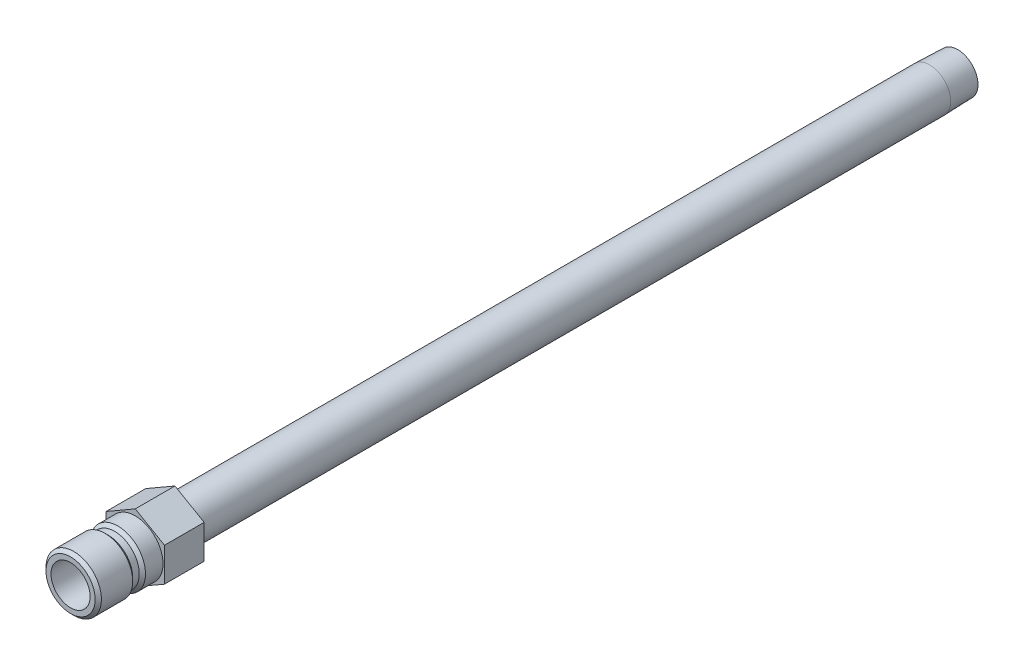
SolidWorks part; units mm, degrees
ref_plane "Front Plane" through (0, 0, 0) normal (0, 0, 1) x (1, 0, 0)
ref_plane "Top Plane" through (0, 0, 0) normal (0, 1, 0) x (1, 0, 0)
ref_plane "Right Plane" through (0, 0, 0) normal (1, 0, 0) x (0, 0, -1)
sketch "Sketch1" plane through (0, 0, 0) normal (1, 0, 0) x (0, 0, -1)
  line L0 (9.652, 0) -> (-18.923, 0) construction
  line L1 (-15.748, 4.7625) -> (-15.748, 5.9817)
  line L2 (-6.604, 5.9817) -> (-6.604, 0) construction
  line L3 (-14.986, 6.7437) -> (-7.366, 6.7437)
  line L4 (9.652, 5.1435) -> (9.652, 0) construction
  line L5 (-6.604, 5.9817) -> (-5.0165, 5.9817)
  line L6 (-4.2545, 6.7437) -> (9.652, 6.7437)
  line L7 (9.652, 6.7437) -> (9.652, 5.1435)
  line L8 (-6.604, 5.9817) -> (-7.366, 6.7437)
  line L9 (-5.0165, 5.9817) -> (-4.2545, 6.7437)
  line L10 (-15.748, 5.9817) -> (-14.986, 6.7437)
  line L11 (-15.748, 4.7625) -> (-3.556, 4.7625)
  line L12 (9.652, 5.1435) -> (193.294, 5.1435)
  line L13 (193.294, 5.1435) -> (200.152, 4.9292)
  line L14 (200.152, 4.9292) -> (200.152, 3.4163)
  line L15 (0, 0) -> (0, 6.7437) construction
  line L16 (9.652, 6.731) -> (9.652, 0) construction
  line L17 (-3.556, 4.7625) -> (-2.8402, 3.4163)
  line L19 (-2.8402, 3.4163) -> (200.152, 3.4163)
  dimension "D2" = 1.5875
  dimension "D3" = 0.762
  dimension "D4" = 45
  dimension "D5" = 9.144
  dimension "D6" = 45
  dimension "D7" = 1.79
  dimension "D8" = 6.858
  dimension "D9" = 215.9
  dimension "D10" = 3.175
  dimension "D11" = 9.525
  dimension "D12" = 10.287
  dimension "D13" = 25.4
  dimension "D14" = 13.4874
  dimension "D15" = 6.8326
  dimension "D16" = 12.192
  dimension "D17" = 9.652
  dimension "D18" = 118
revolve "Revolve1" add sketch "Sketch1" angle 360 about L0
sketch "Sketch2" plane through (0, 0, 0) normal (0, 0, 1) x (1, 0, 0)
  line L1 (-7.112, 4.1061) -> (-7.112, -4.1061)
  line L2 (-7.112, -4.1061) -> (0, -8.2122)
  line L3 (0, -8.2122) -> (7.112, -4.1061)
  line L4 (7.112, -4.1061) -> (7.112, 4.1061)
  line L5 (7.112, 4.1061) -> (0, 8.2122)
  line L6 (0, 8.2122) -> (-7.112, 4.1061)
  circle A0 centre (0, 0) radius 7.112 construction
  circle A1 centre (0, 0) radius 4.7625 construction
  circle A2 centre (0, 0) radius 4.7625
  dimension "D1" = 14.224
extrude "Boss-Extrude1" add sketch "Sketch2" against normal up to vertex (9.652 mm away)
